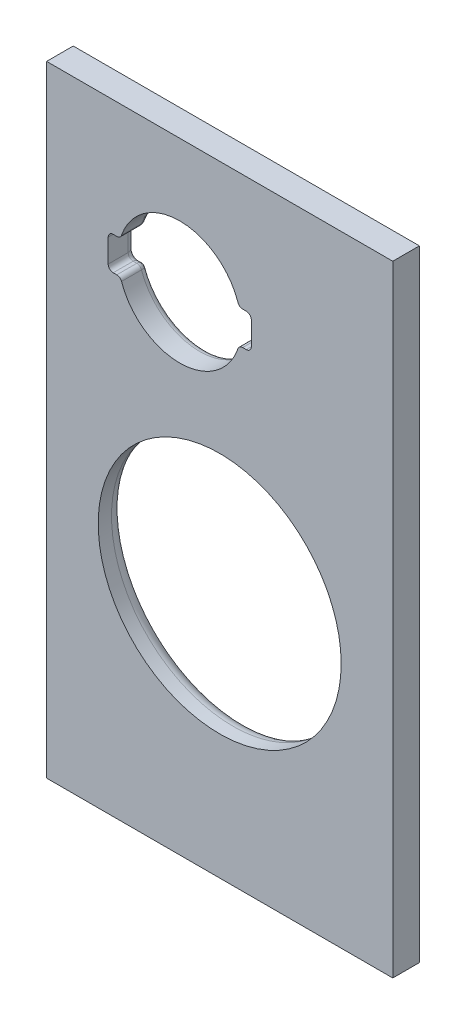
SolidWorks part; units mm, degrees
ref_plane "Спереди" through (0, 0, 0) normal (0, 0, 1) x (1, 0, 0)
ref_plane "Сверху" through (0, 0, 0) normal (0, 1, 0) x (1, 0, 0)
ref_plane "Справа" through (0, 0, 0) normal (1, 0, 0) x (0, 0, -1)
sketch "Эскиз1" plane through (0, 0, 0) normal (0, 0, 1) x (1, 0, 0)
  line L1 (-104, 186.5) -> (104, 186.5)
  line L2 (-104, 186.5) -> (-104, -186.5)
  line L3 (-104, -186.5) -> (104, -186.5)
  line L4 (104, 186.5) -> (104, -186.5)
  line L5 (-104, 186.5) -> (104, -186.5) construction
  line L6 (-104, -186.5) -> (104, 186.5) construction
  point P0 (0, 0)
extrude "Бобышка-Вытянуть1" add sketch "Эскиз1" along normal blind 16
sketch "Эскиз2" plane through (0, 0, 16) normal (0, 0, 1) x (1, 0, 0)
  line L0 (-64, 116.5027) -> (-61.8286, 116.5027)
  line L1 (16, 96.5027) -> (13.8286, 96.5027)
  line L2 (-67, 113.5027) -> (-67, 99.5027)
  line L3 (19, 113.5027) -> (19, 99.5027)
  line L4 (13.8286, 116.5027) -> (16, 116.5027)
  line L5 (-61.8286, 96.5027) -> (-64, 96.5027)
  arc A0 (-58.9914, 94.4777) -> (10.9914, 94.4777) centre (-24, 106.5027) ccw
  arc A1 (10.9914, 118.5277) -> (-58.9914, 118.5277) centre (-24, 106.5027) ccw
  arc A2 (-67, 113.5027) -> (-64, 116.5027) centre (-64, 113.5027) cw
  arc A3 (-61.8286, 116.5027) -> (-58.9914, 118.5277) centre (-61.8286, 119.5027) ccw
  arc A4 (-64, 96.5027) -> (-67, 99.5027) centre (-64, 99.5027) cw
  arc A5 (-58.9914, 94.4777) -> (-61.8286, 96.5027) centre (-61.8286, 93.5027) ccw
  arc A6 (19, 113.5027) -> (16, 116.5027) centre (16, 113.5027) ccw
  arc A7 (16, 96.5027) -> (19, 99.5027) centre (16, 99.5027) ccw
  arc A8 (13.8286, 96.5027) -> (10.9914, 94.4777) centre (13.8286, 93.5027) ccw
  arc A9 (13.8286, 116.5027) -> (10.9914, 118.5277) centre (13.8286, 119.5027) cw
  circle A10 centre (0, -38.4973) radius 73
  point P18 (-59.623, 96.5027)
  point P27 (11.623, 116.5027)
  dimension "D1" = 3
  dimension "D2" = 3
  dimension "D3" = 3
  dimension "D4" = 3
  dimension "D5" = 3
  dimension "D6" = 3
  dimension "D7" = 3
  dimension "D8" = 3
extrude "Вырез-Вытянуть1" cut sketch "Эскиз2" against normal blind 16
fillet "Скругление1" radius 8 1 edges at (73, -38.4973, 0)
fillet "Скругление4" radius 4 16 edges at (12.0857, 117.0609, 0) (14.9143, 116.5027, 0) (18.1213, 115.624, 0) (19, 106.5027, 0) (18.1213, 97.3814, 0) (14.9143, 96.5027, 0) (12.0857, 95.9445, 0) (-24, 69.5027, 0) (-60.0857, 95.9445, 0) (-62.9143, 96.5027, 0) (-66.1213, 97.3814, 0) (-67, 106.5027, 0) (-66.1213, 115.624, 0) (-62.9143, 116.5027, 0) (-60.0857, 117.0609, 0) (-24, 143.5027, 0)
